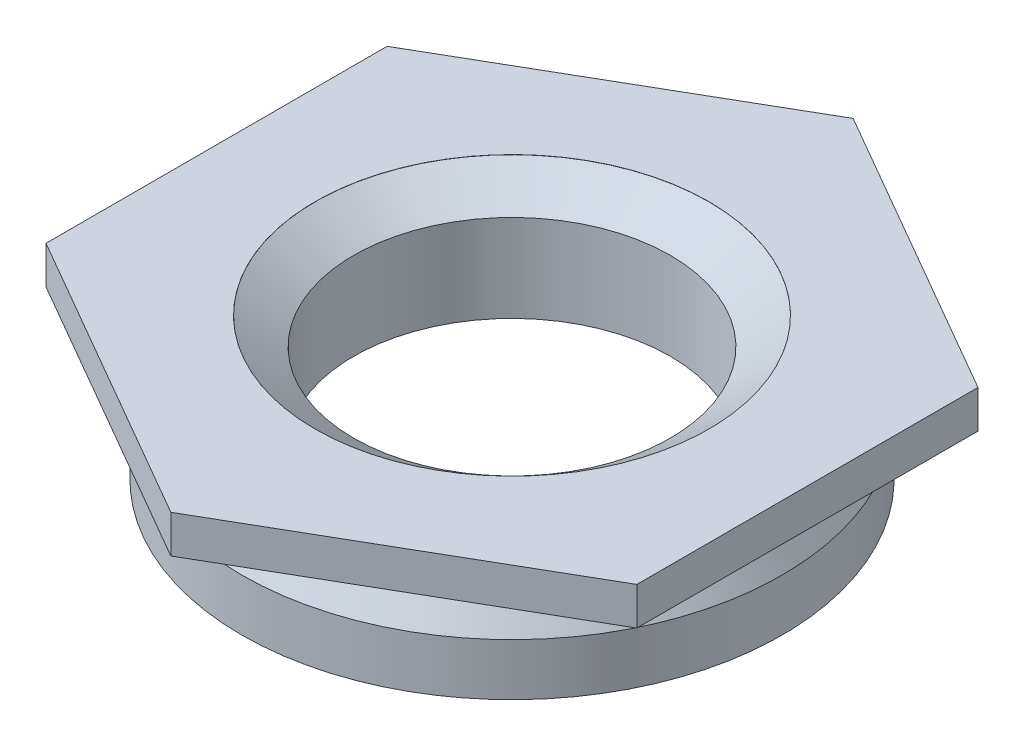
SolidWorks part; units mm, degrees
ref_plane "Plane1" through (0, 0, 0) normal (0, 0, 1) x (1, 0, 0)
ref_plane "Plane2" through (0, 0, 0) normal (0, 1, 0) x (1, 0, 0)
ref_plane "Plane3" through (0, 0, 0) normal (1, 0, 0) x (0, 0, -1)
sketch "BodySke" plane through (0, 0, 0) normal (0, 0, 1) x (1, 0, 0)
  line L0 (4.0481, 0) -> (5.5118, 0)
  line L1 (5.5118, 0) -> (5.5118, 0.6096)
  line L2 (5.5118, 0.6096) -> (2.5527, 0.6096)
  line L3 (2.5527, 0.6096) -> (2.5527, -1.6764)
  line L4 (2.5527, -1.6764) -> (4.3561, -1.6764)
  line L5 (4.3561, -1.6764) -> (4.3561, -0.8382)
  line L6 (4.3561, -0.8382) -> (4.0481, -0.3048)
  line L7 (1.016, 1.27) -> (3.6522, 1.27) construction
  line L9 (0, 0) -> (0, 15.24) construction
  line L10 (4.0481, -0.3048) -> (4.0481, 0)
  dimension "D1" = 60
  dimension "E_dia" = 11.0236
  dimension "C_dia" = 8.7122
  dimension "A_ht" = 1.6764
  dimension "Thread_min" = 5.1054
  dimension "C_len" = 0.8382
  dimension "Clinching_ht" = 0.3048
  dimension "Advance" = 1.27
  dimension "Thickness" = 2.286
revolve "Body" add sketch "BodySke"
revolve "EndChamfer" cut sketch "EndChamferSke" angle 360 about L0
sketch "EndChamferSke" plane through (0, 0, 0) normal (0, 0, 1) x (1, 0, 0)
  line L0 (0, -2.54) -> (0, 7.62) construction
  line L1 (0, 0) -> (0, 15.24) construction
  line L2 (3.175, -1.9304) -> (3.175, -1.6739)
  line L3 (3.175, -1.6739) -> (2.5527, -1.2383)
  line L4 (2.5527, -1.2383) -> (2.5527, -1.9304)
  line L5 (2.5527, -1.9304) -> (3.175, -1.9304)
  line L6 (3.175, 0.6071) -> (2.5527, 0.1715)
  line L7 (3.175, 0.6071) -> (3.175, 0.8636)
  line L8 (2.5527, 0.1715) -> (2.5527, 0.8636)
  line L9 (3.175, 0.8636) -> (2.5527, 0.8636)
  line L11 (-4.3561, -1.6764) -> (4.3561, -1.6764) construction
  line L12 (5.5118, 0.6096) -> (-5.5118, 0.6096) construction
  dimension "D1" = 0.254
  dimension "Thread_nominal" = 6.35
  dimension "D2" = 34.99
  dimension "D3" = 0.254
  dimension "Thread_min" = 5.1054
  dimension "Inset" = 0.0025
  dimension "Inset_far" = 0.0025
ref_plane "Plane4" through (0, -0.5486, 0) normal (0, 1, 0) x (-1, 0, 0)
sketch "ThdSchSke" plane through (0, 0, 0) normal (0, 0, 1) x (1, 0, 0)
  line L0 (0, -5.08) -> (0, 7.62) construction
  line L1 (0, 0) -> (0, 15.24) construction
  line L2 (0, -1.6739) -> (3.175, -1.6739) construction
  line L4 (3.175, -1.6739) -> (2.5527, -1.2381)
  line L6 (3.175, -1.6739) -> (2.5527, -2.1096)
  line L7 (2.5527, -1.2381) -> (2.5527, -2.1096)
  line L8 (3.175, -1.6739) -> (-3.175, -1.6739) construction
  dimension "Vee_angle" = 70
  dimension "Thread_nominal" = 6.35
  dimension "Thread_min" = 5.1054
revolve "ThreadSchematic" [suppressed] cut sketch "ThdSchSke" angle 360 about L0
pattern_linear "ThdSchPat" [suppressed]
sketch "HexDieSke" plane through (0, 0.6096, 0) normal (0, 1, 0) x (-1, 0, 0)
  line L0 (0, 5.4993) -> (4.7625, 2.7496)
  line L1 (4.7625, 2.7496) -> (4.7625, -2.7496)
  line L2 (4.7625, -2.7496) -> (0, -5.4993)
  line L3 (0, -5.4993) -> (-4.7625, -2.7496)
  line L4 (-4.7625, -2.7496) -> (-4.7625, 2.7496)
  line L5 (-4.7625, 2.7496) -> (0, 5.4993)
  circle A1 centre (0, 0) radius 4.7625 construction
  circle A2 centre (0, 0) radius 5.4993 construction
  circle A3 centre (0, 0) radius 5.5372
  dimension "Width_across_flats" = 9.525
  dimension "OD" = 11.0744
extrude "HexDie" cut sketch "HexDieSke" against normal blind 0.6096
equation "' \"Thickness@BodySke\" = 0.09"
equation "' \"C_dia@BodySke\" = 0.343"
equation "' \"Width_across_flats@HexDieSke\" = 0.375"
equation "' \"Advance@BodySke\" = 0.05"
equation "' \"Thread_min@BodySke\" = 0.201"
equation "' \"Thread_nominal@ThreadCosmetic\" = 0.25"
equation "\"OD@HexDieSke\" =  \"Width_across_flats@HexDieSke\" * 1.16 + 0.001"
equation "\"E_dia@BodySke\" = \"Width_across_flats@HexDieSke\" * 1.16 - 0.001"
equation "\"A_ht@BodySke\" = \"Thickness@BodySke\" - 0.06 * 0.4"
equation "\"Depth@HexDie\" = \"Thickness@BodySke\" - \"A_ht@BodySke\""
equation "\"Clinching_ht@BodySke\" = 0.012 '  \"Thickness@BodySke\" - 0.06 * 0.8"
equation "\"C_len@BodySke\" =  \"Thickness@BodySke\" - 0.057"
equation "\"Thread_nominal@EndChamferSke\" = \"Thread_nominal@ThreadCosmetic\""
equation "\"Thread_min@EndChamferSke\" = \"Thread_min@BodySke\""
equation "\"D2@EndChamferSke\" = \"Vee_angle@ThdSchSke\" / 2 - 0.01"
equation "\"Thread_nominal@ThdSchSke\" = \"Thread_nominal@ThreadCosmetic\""
equation "\"Thread_min@ThdSchSke\" = \"Thread_min@BodySke\""
equation "\"Num_threads@ThdSchPat\" = int(  ( \"Thickness@BodySke\" - \"Inset@EndChamferSke\" - \"Inset_far@EndChamferSke\" ) / \"Advance@BodySke\" + 0.999 )  + 1"
equation "\"Advance@ThdSchPat\" = (  \"Thickness@BodySke\" - \"Inset@EndChamferSke\" - \"Inset_far@EndChamferSke\"  ) /  (\"Num_threads@ThdSchPat\" - 1) 'relax it"
